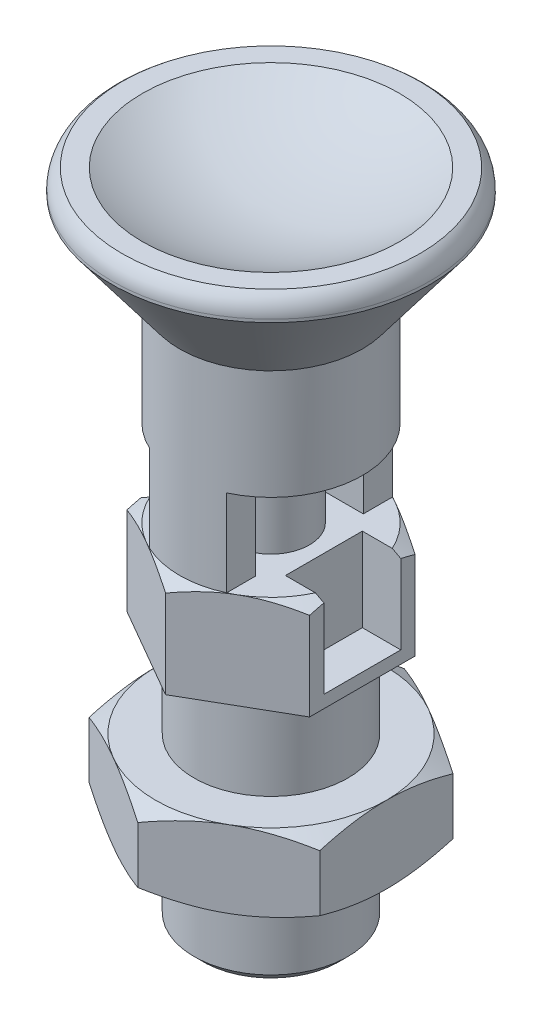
SolidWorks part; units mm, degrees
ref_plane "Plan de face" through (0, 0, 0) normal (0, 0, 1) x (1, 0, 0)
ref_plane "Plan de dessus" through (0, 0, 0) normal (0, 1, 0) x (1, 0, 0)
ref_plane "Plan de droite" through (0, 0, 0) normal (1, 0, 0) x (0, 0, -1)
imported_body "Importée3"
sketch "Esquisse1" plane through (0, 20.4, 0) normal (0, 1, 0) x (-1, 0, 0)
  line L0 (8.6168, -4) -> (9.5, -4)
  line L1 (9.5, -4) -> (9.5, 0)
  arc A0 (9.5, 0) -> (8.6168, -4) centre (0, 0) cw
extrude "Enlèv. mat.-Extru.1" cut sketch "Esquisse1" against normal blind 20.4
sketch "Esquisse2" plane through (0, 20.4, 0) normal (0, 1, 0) x (-1, 0, 0)
  line L0 (9.5, 0) -> (9.5, 4)
  line L1 (9.5, 4) -> (8.6168, 4)
  arc A0 (8.6168, 4) -> (9.5, 0) centre (0, 0) cw
extrude "Enlèv. mat.-Extru.2" cut sketch "Esquisse2" against normal blind 20.4
ref_plane "Plan1" through (0, 0, 0) normal (0, -1, 0) x (1, 0, 0)
sketch "Esquisse3" plane through (0, 0, 0) normal (0, -1, 0) x (1, 0, 0)
  line L0 (4, 8.6168) -> (4, 5.6)
  line L1 (4, 5.6) -> (-4, 5.6)
  line L2 (-4, 5.6) -> (-4, 8.6168)
  line L3 (-4, -8.6168) -> (-4, -5.6)
  line L4 (-4, -5.6) -> (4, -5.6)
  line L5 (4, -5.6) -> (4, -8.6168)
  arc A0 (4, -8.6168) -> (4, 8.6168) centre (0, 0) ccw
  arc A1 (-4, 8.6168) -> (-4, -8.6168) centre (0, 0) ccw
  circle A2 centre (0, 0) radius 4
extrude "Enlèv. mat.-Extru.3" cut sketch "Esquisse3" against normal blind 8
sketch "Esquisse4" plane through (9.5, 0, 0) normal (1, 0, 0) x (0, 0, -1)
  line L0 (-4, 0) -> (-4, -0.4664)
  line L1 (-4, -0.4664) -> (4, -0.4664)
  line L2 (4, -0.4664) -> (4, 0)
  line L3 (4, 0) -> (-4, 0)
extrude "Enlèv. mat.-Extru.4" cut sketch "Esquisse4" against normal blind 0.8832
sketch "Esquisse5" plane through (-9.5, 0, 0) normal (-1, 0, 0) x (0, 0, 1)
  line L0 (-4, 0) -> (-4, -0.4664)
  line L1 (-4, -0.4664) -> (4, -0.4664)
  line L2 (4, -0.4664) -> (4, 0)
  line L3 (4, 0) -> (-4, 0)
extrude "Enlèv. mat.-Extru.5" cut sketch "Esquisse5" against normal blind 0.8832
sketch "Esquisse6" plane through (8.6168, 0, 0) normal (1, 0, 0) x (0, 0, -1)
  line L0 (-4, 0) -> (-4, -0.4664)
  line L1 (-4, -0.4664) -> (4, -0.4664)
  line L2 (4, -0.4664) -> (4, 0)
  line L3 (4, 0) -> (-4, 0)
extrude "Enlèv. mat.-Extru.6" cut sketch "Esquisse6" against normal blind 3.1168
sketch "Esquisse7" plane through (0, -0.4664, 0) normal (0, 1, 0) x (-1, 0, 0)
  line L0 (-5.5, -4) -> (-5.5, 4)
  line L1 (-5.5, 4) -> (-9.5, 4)
  line L2 (-9.5, 4) -> (-9.5, -4)
  line L3 (-9.5, -4) -> (-5.5, -4)
extrude "Enlèv. mat.-Extru.7" cut sketch "Esquisse7" against normal blind 8.2336
sketch "Esquisse8" plane through (0, -0.4664, 0) normal (0, 1, 0) x (-1, 0, 0)
  line L0 (9.5, 4) -> (8.6168, 4)
  line L1 (8.6168, 4) -> (8.6168, -4)
  line L2 (8.6168, -4) -> (9.5, -4)
  line L3 (9.5, -4) -> (9.5, 4)
extrude "Enlèv. mat.-Extru.8" cut sketch "Esquisse8" against normal blind 8.2336
sketch "Esquisse9" plane through (-8.6168, 0, 0) normal (-1, 0, 0) x (0, 0, 1)
  line L0 (4, -8.7) -> (4, 0)
  line L1 (4, 0) -> (-4, 0)
  line L2 (-4, 0) -> (-4, -8.7)
  line L3 (-4, -8.7) -> (4, -8.7)
extrude "Enlèv. mat.-Extru.9" cut sketch "Esquisse9" against normal blind 3.1168
ref_plane "Plan2" through (0, 9, 0) normal (0, 1, 0) x (1, 0, 0)
sketch "Esquisse10" plane through (0, 9, 0) normal (0, 1, 0) x (1, 0, 0)
  line L0 (4, 8.6168) -> (4, -8.6168)
  arc A0 (4, -8.6168) -> (4, 8.6168) centre (0, 0) ccw
extrude "Enlèv. mat.-Extru.10" cut sketch "Esquisse10" against normal up to next
sketch "Esquisse11" plane through (0, 8, 0) normal (0, -1, 0) x (1, 0, 0)
  line L0 (-4, -8.6168) -> (-4, 8.6168)
  arc A0 (-4, 8.6168) -> (-4, -8.6168) centre (0, 0) ccw
extrude "Enlèv. mat.-Extru.11" cut sketch "Esquisse11" against normal blind 1
chamfer "Chanfrein1" distance 0.92 angle 45 1 edges at (0, -36, -8)
